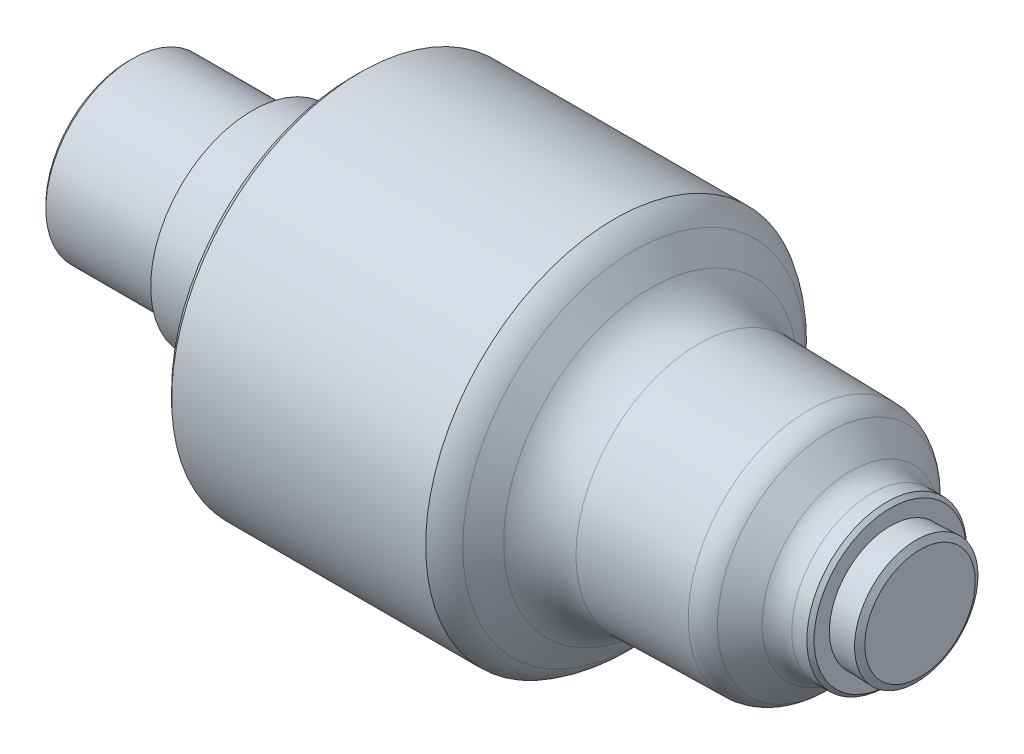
SolidWorks part; units mm, degrees
ref_plane "Ebene vorne" through (0, 0, 0) normal (0, 0, 1) x (1, 0, 0)
ref_plane "Ebene oben" through (0, 0, 0) normal (0, 1, 0) x (1, 0, 0)
ref_plane "Ebene rechts" through (0, 0, 0) normal (1, 0, 0) x (0, 0, -1)
sketch "Skizze1" plane through (0, 0, 0) normal (0, 0, 1) x (1, 0, 0)
  line L0 (9.6088, 8.3421) -> (10.6405, 8.3421)
  line L1 (9.6088, 8.3421) -> (9.5468, 8.2801)
  line L2 (9.6088, 5.0921) -> (9.5468, 5.1541)
  line L3 (13.6093, 5.0921) -> (13.7968, 5.0921)
  line L4 (14.1718, 7.3736) -> (14.1718, 6.0606)
  line L5 (12.535, 7.7481) -> (13.4861, 7.7481)
  line L6 (14.1408, 7.4046) -> (13.9869, 7.4046)
  line L7 (14.1408, 7.4046) -> (14.1718, 7.3736)
  line L8 (11.9647, 8.1909) -> (12.1254, 7.9613)
  line L9 (13.8845, 7.4579) -> (13.7932, 7.5882)
  line L10 (14.1408, 6.0296) -> (14.0468, 6.0296)
  line L11 (14.1408, 6.0296) -> (14.1718, 6.0606)
  line L12 (13.9218, 5.9046) -> (13.9218, 5.2171)
  line L13 (19.5501, 6.7171) -> (19.5501, 5.4611)
  line L14 (17.4881, 6.7171) -> (17.4881, 5.4611)
  line L15 (3.1815, 6.7171) -> (1.5785, 6.7171) construction
  line L16 (3.3315, 6.8671) -> (3.3315, 8.741) construction
  line L17 (3.4815, 6.7171) -> (5.0645, 6.7171) construction
  line L18 (3.3315, 6.5671) -> (3.3315, 4.9879) construction
  line L19 (2.7255, 7.8537) -> (3.066, 7.8537)
  line L20 (3.9375, 7.8537) -> (3.5971, 7.8537)
  line L21 (12.9218, 6.3671) -> (12.9218, 5.1453) construction
  line L22 (11.3898, 5.5929) -> (11.3898, 5.0369) construction
  line L23 (9.6088, 5.0921) -> (11.2203, 5.0921)
  line L24 (13.6093, 5.2791) -> (12.2343, 5.2791)
  line L25 (12.2343, 5.2791) -> (12.2343, 5.0921)
  line L26 (13.6093, 5.2791) -> (13.6093, 5.0921)
  line L27 (11.5593, 5.0921) -> (12.2343, 5.0921)
  line L28 (13.5778, 5.3491) -> (12.2658, 5.3491)
  line L29 (12.2343, 5.2791) -> (12.2658, 5.3491)
  line L30 (13.6093, 5.2791) -> (13.5778, 5.3491)
  line L31 (13.5063, 5.3904) -> (13.4856, 5.9856)
  line L32 (13.5778, 5.3491) -> (13.5063, 5.3904)
  line L33 (12.3372, 5.3904) -> (12.3439, 5.5808)
  line L34 (12.2658, 5.3491) -> (12.3372, 5.3904)
  line L35 (12.3372, 5.3904) -> (13.5063, 5.3904)
  line L36 (14.1718, 7.2418) -> (14.3954, 7.2486)
  line L37 (14.1718, 6.1933) -> (14.3959, 6.1865)
  line L38 (8.8378, 7.5921) -> (8.8378, 7.4646)
  line L39 (8.7408, 7.5921) -> (8.7408, 5.8421)
  line L40 (8.7408, 7.5921) -> (8.8378, 7.5921)
  line L41 (8.7408, 5.8421) -> (8.8378, 5.8421)
  line L42 (7.356, 6.7171) -> (8.6726, 6.7171) construction
  line L43 (14.4278, 7.1926) -> (14.4278, 6.2417)
  line L44 (14.4278, 7.1926) -> (14.3954, 7.2486)
  line L45 (14.4278, 6.2417) -> (14.3959, 6.1865)
  line L46 (8.8378, 7.4646) -> (9.5468, 7.4646)
  line L47 (8.8378, 5.9696) -> (9.5468, 5.9696)
  line L48 (9.5468, 8.2801) -> (9.5468, 5.1541)
  line L49 (8.8378, 5.9696) -> (8.8378, 5.8421)
  line L50 (9.6088, 5.0921) -> (9.6088, 8.3421)
  line L51 (13.6427, 11.5171) -> (13.8316, 11.7127)
  line L52 (13.6427, 13.4359) -> (13.8316, 13.2404)
  line L53 (9.6088, 10.851) -> (9.6088, 14.102)
  line L54 (9.5468, 10.913) -> (9.5468, 14.04)
  line L55 (9.6088, 10.851) -> (11.7962, 10.851)
  line L56 (9.6088, 10.851) -> (9.5468, 10.913)
  line L57 (9.6088, 14.102) -> (11.7962, 14.102)
  line L58 (9.6088, 14.102) -> (9.5468, 14.04)
  line L59 (14.4877, 12.4765) -> (10.6547, 12.4765) construction
  line L60 (12.519, 13.5308) -> (13.4678, 13.5122)
  line L61 (14.0114, 11.789) -> (14.1408, 11.789)
  line L62 (14.0114, 13.164) -> (14.1408, 13.164)
  line L63 (7.5025, 12.4765) -> (10.1889, 12.4765) construction
  line L64 (8.8378, 12.9314) -> (8.8378, 12.0217) construction
  line L65 (8.7408, 13.3515) -> (8.7408, 11.6015)
  line L66 (8.7408, 11.6015) -> (9.5468, 11.6015)
  line L67 (8.8378, 12.0217) -> (9.5468, 12.0217)
  line L68 (8.7408, 13.3515) -> (9.5468, 13.3515)
  line L69 (8.8378, 12.9314) -> (9.5468, 12.9314)
  line L70 (11.7962, 8.3421) -> (11.7962, 5.0921)
  line L71 (12.4128, 6.8844) -> (12.4128, 7.57)
  line L72 (13.9291, 7.2958) -> (13.9291, 6.1438)
  line L73 (13.4945, 5.9856) -> (12.6723, 5.9856)
  line L74 (13.557, 6.0481) -> (13.557, 6.1184)
  line L75 (14.3959, 6.1865) -> (14.3954, 7.2486)
  line L76 (14.3959, 11.9459) -> (14.3954, 13.008)
  line L77 (14.4278, 12.952) -> (14.4278, 12.0011)
  line L78 (14.1718, 13.0012) -> (14.3954, 13.008)
  line L79 (14.4278, 12.952) -> (14.3954, 13.008)
  line L80 (14.4278, 12.0011) -> (14.3959, 11.9459)
  line L81 (14.1718, 11.9527) -> (14.3959, 11.9459)
  line L82 (14.1408, 6.0296) -> (14.1408, 7.4046)
  line L83 (18.4291, 6.7171) -> (18.6091, 6.7171) construction
  line L84 (18.5191, 6.6271) -> (18.5191, 6.8071) construction
  line L85 (18.3391, 6.7171) -> (16.8041, 6.7171) construction
  line L86 (18.6991, 6.7171) -> (20.2341, 6.7171) construction
  line L87 (18.5191, 6.5371) -> (18.5191, 5.0021) construction
  line L88 (18.5191, 6.8971) -> (18.5206, 8.8156) construction
  line L89 (13.5379, 6.8844) -> (13.5379, 7.57)
  line L90 (14.1408, 11.789) -> (14.1408, 13.164)
  line L91 (14.1718, 13.133) -> (14.1718, 11.82)
  line L92 (14.1408, 11.789) -> (14.1718, 11.82)
  line L93 (14.1408, 13.164) -> (14.1718, 13.133)
  line L94 (11.7962, 14.102) -> (11.7962, 10.851)
  line L95 (11.9647, 13.9508) -> (12.1095, 13.744)
  line L96 (12.519, 11.4222) -> (13.4678, 11.4409)
  line L97 (11.9647, 11.0022) -> (12.1095, 11.209)
  line L98 (13.9291, 13.0552) -> (13.9291, 11.9032)
  line L99 (13.5379, 11.6703) -> (13.5379, 13.3294)
  line L100 (12.4128, 11.6323) -> (12.4128, 13.3294)
  line L101 (19.1965, 8.2549) -> (19.1844, 8.2305)
  line L102 (19.2441, 8.2384) -> (19.2853, 8.2179)
  line L103 (19.2296, 8.2386) -> (19.2174, 8.214)
  line L104 (19.3273, 8.19) -> (19.3151, 8.1656)
  line L105 (19.2943, 8.2065) -> (19.282, 8.1819)
  line L106 (19.3478, 8.1149) -> (19.358, 8.1321)
  line L107 (17.7139, 8.19) -> (17.726, 8.1656)
  line L108 (17.6934, 8.1149) -> (17.6832, 8.1321)
  line L109 (17.8446, 8.2549) -> (17.8568, 8.2305)
  line L110 (17.797, 8.2384) -> (17.7558, 8.2179)
  line L111 (17.8115, 8.2386) -> (17.8238, 8.214)
  line L112 (17.7469, 8.2065) -> (17.7591, 8.1819)
  line L113 (11.6405, 13.3104) -> (10.7655, 13.3104)
  line L114 (10.6405, 13.202) -> (10.6405, 11.751) construction
  line L115 (11.7655, 13.202) -> (11.7655, 11.751) construction
  line L116 (11.6405, 11.6427) -> (10.7655, 11.6427)
  line L117 (11.5864, 11.7823) -> (11.5864, 11.7044)
  line L118 (11.6947, 11.7823) -> (11.6947, 11.7044)
  line L119 (11.6947, 11.7044) -> (11.6405, 11.672)
  line L120 (11.5864, 11.7044) -> (11.6405, 11.672)
  line L121 (11.6405, 11.8136) -> (11.6405, 11.8002)
  line L122 (11.6947, 11.7823) -> (11.6405, 11.8136)
  line L123 (11.5864, 11.7823) -> (11.6405, 11.8136)
  line L124 (10.7114, 11.7823) -> (10.7114, 11.7044)
  line L125 (10.8197, 11.7823) -> (10.8197, 11.7044)
  line L126 (10.8197, 11.7044) -> (10.7655, 11.672)
  line L127 (10.7114, 11.7044) -> (10.7655, 11.672)
  line L128 (10.8197, 11.7823) -> (10.7655, 11.8136)
  line L129 (10.7114, 11.7823) -> (10.7655, 11.8136)
  line L130 (10.7655, 11.8136) -> (10.7655, 11.8002)
  line L145 (11.6405, 8.1334) -> (10.7655, 8.1334)
  line L146 (10.8197, 8.1749) -> (10.8197, 8.2338)
  line L147 (10.7114, 8.1749) -> (10.7114, 8.2338)
  line L148 (10.8197, 8.2338) -> (10.7655, 8.2524)
  line L149 (10.7114, 8.2338) -> (10.7655, 8.2524)
  line L150 (10.8197, 8.1749) -> (10.7655, 8.1574)
  line L151 (10.7655, 8.1574) -> (10.7655, 8.1707)
  line L152 (10.7114, 8.1749) -> (10.7655, 8.1574)
  line L153 (11.6405, 8.1149) -> (10.7655, 8.1149)
  line L154 (10.6405, 8.3621) -> (11.7655, 8.3621)
  line L155 (10.6405, 8.1735) -> (10.6405, 8.3621)
  line L156 (11.7655, 8.1735) -> (11.7655, 8.3621)
  line L157 (11.7655, 8.3421) -> (11.7962, 8.3421)
  line L158 (11.6405, 8.1574) -> (11.6405, 8.1707)
  line L159 (11.5864, 8.1749) -> (11.6405, 8.1574)
  line L160 (11.6947, 8.1749) -> (11.6405, 8.1574)
  line L161 (11.6947, 8.2338) -> (11.6405, 8.2524)
  line L162 (11.5864, 8.2338) -> (11.6405, 8.2524)
  line L163 (11.5864, 8.1749) -> (11.5864, 8.2338)
  line L164 (11.6947, 8.1749) -> (11.6947, 8.2338)
  line L165 (18.8003, 6.8795) -> (18.5191, 7.0419)
  line L166 (18.5191, 7.0419) -> (18.2378, 6.8795)
  line L167 (18.2378, 6.8795) -> (18.2378, 6.5547)
  line L168 (18.2378, 6.5547) -> (18.5191, 6.3924)
  line L169 (18.5191, 6.3924) -> (18.8003, 6.5547)
  line L170 (18.8003, 6.5547) -> (18.8003, 6.8795)
  line L171 (7.6468, 7.4631) -> (8.5939, 7.4631)
  line L172 (7.6158, 7.4321) -> (7.6158, 6.7171)
  line L173 (7.6468, 7.4631) -> (7.6158, 7.4321)
  line L174 (8.6783, 7.5921) -> (8.6783, 7.4046)
  line L175 (8.6341, 7.4229) -> (8.5939, 7.4631)
  line L176 (8.6783, 7.4671) -> (8.7408, 7.4671)
  line L177 (8.6783, 7.5921) -> (8.7408, 7.5921)
  line L178 (7.6468, 7.4631) -> (7.6468, 6.7171)
  line L179 (8.5939, 7.4631) -> (8.5939, 6.7171)
  line L180 (8.5939, 5.9711) -> (8.5939, 6.7171)
  line L181 (7.6468, 5.9711) -> (7.6468, 6.7171)
  line L182 (7.6158, 6.0021) -> (7.6158, 6.7171)
  line L183 (7.6468, 5.9711) -> (8.5939, 5.9711)
  line L184 (7.6468, 5.9711) -> (7.6158, 6.0021)
  line L185 (8.6793, 5.8421) -> (8.6793, 6.0296)
  line L186 (8.6341, 6.0113) -> (8.5939, 5.9711)
  line L187 (8.6793, 5.9671) -> (8.7408, 5.9671)
  line L188 (8.6793, 5.8421) -> (8.7408, 5.8421)
  line L189 (8.6783, 11.6015) -> (8.6783, 12.4765)
  line L190 (8.6783, 11.6015) -> (8.7408, 11.6015)
  line L191 (8.5939, 13.2225) -> (8.5939, 12.4765)
  line L192 (7.6468, 13.2225) -> (7.6468, 12.4765)
  line L193 (7.6158, 13.1915) -> (7.6158, 12.4765)
  line L194 (7.6468, 11.7305) -> (8.5939, 11.7305)
  line L195 (7.6158, 11.7615) -> (7.6158, 12.4765)
  line L196 (7.6468, 11.7305) -> (7.6468, 12.4765)
  line L197 (7.6468, 11.7305) -> (7.6158, 11.7615)
  line L198 (8.5939, 11.7305) -> (8.5939, 12.4765)
  line L199 (8.6341, 11.7707) -> (8.5939, 11.7305)
  line L200 (7.6468, 13.2225) -> (8.5939, 13.2225)
  line L201 (7.6468, 13.2225) -> (7.6158, 13.1915)
  line L202 (8.6783, 13.3515) -> (8.6783, 12.4765)
  line L203 (8.6341, 13.1823) -> (8.5939, 13.2225)
  line L204 (8.6783, 13.3515) -> (8.7408, 13.3515)
  line L205 (9.6088, 6.7171) -> (14.4891, 6.7171) construction
  line L206 (3.3815, 6.7171) -> (3.2815, 6.7171) construction
  line L207 (3.3315, 6.6671) -> (3.3315, 6.7671) construction
  line L208 (3.191, 7.9787) -> (3.191, 8.0507)
  line L209 (3.4721, 7.9787) -> (3.4721, 8.0507)
  line L210 (3.5117, 8.3421) -> (3.1513, 8.3421)
  line L211 (3.1513, 8.4303) -> (3.2854, 8.4303)
  line L212 (2.5264, 8.19) -> (2.5385, 8.1656)
  line L213 (2.5058, 8.1149) -> (2.4956, 8.1321)
  line L214 (2.6095, 8.2384) -> (2.5683, 8.2179)
  line L215 (2.5593, 8.2065) -> (2.5716, 8.1819)
  line L216 (2.6571, 8.2549) -> (2.6692, 8.2305)
  line L217 (2.624, 8.2386) -> (2.6362, 8.214)
  line L218 (3.1513, 8.4303) -> (3.1513, 8.3421)
  line L219 (3.2442, 8.4303) -> (3.2442, 8.3448)
  line L220 (3.3776, 8.4303) -> (3.5117, 8.4303)
  line L221 (3.2854, 8.3723) -> (3.3776, 8.3723)
  line L222 (3.4188, 8.4303) -> (3.4188, 8.3448)
  line L223 (3.2854, 8.4303) -> (3.2854, 8.3723)
  line L224 (3.3776, 8.4303) -> (3.3776, 8.3723)
  line L225 (3.5117, 8.4303) -> (3.5117, 8.3421)
  line L226 (4.1067, 8.2065) -> (4.0945, 8.1819)
  line L227 (4.0421, 8.2386) -> (4.0298, 8.214)
  line L228 (4.0566, 8.2384) -> (4.0978, 8.2179)
  line L229 (4.009, 8.2549) -> (3.9969, 8.2305)
  line L230 (4.1397, 8.19) -> (4.1276, 8.1656)
  line L231 (4.1603, 8.1149) -> (4.1705, 8.1321)
  line L232 (18.4741, 8.3723) -> (18.5663, 8.3723)
  line L233 (18.34, 8.4303) -> (18.34, 8.3524)
  line L234 (18.4329, 8.4303) -> (18.4329, 8.3599)
  line L235 (18.4741, 8.4303) -> (18.4741, 8.3723)
  line L236 (18.34, 8.4303) -> (18.4741, 8.4303)
  line L237 (18.6075, 8.4303) -> (18.6075, 8.3597)
  line L238 (18.7004, 8.4303) -> (18.7004, 8.3521)
  line L239 (18.5663, 8.4303) -> (18.5663, 8.3723)
  line L240 (18.5663, 8.4303) -> (18.7004, 8.4303)
  line L241 (10.2547, 8.4276) -> (10.5667, 8.4276)
  line L242 (10.2547, 8.4276) -> (10.2547, 8.3421)
  line L243 (10.5667, 8.4276) -> (10.5667, 8.3421)
  line L244 (10.4107, 8.4276) -> (10.4107, 8.3421)
  line L245 (10.4107, 12.2964) -> (10.5667, 12.3864)
  line L246 (10.5667, 12.3864) -> (10.5667, 12.5666)
  line L247 (10.5667, 12.5666) -> (10.4107, 12.6567) construction
  line L248 (10.4107, 12.6567) -> (10.2547, 12.5666)
  line L249 (10.2547, 12.5666) -> (10.2547, 12.3864)
  line L250 (10.2547, 12.3864) -> (10.4107, 12.2964)
  line L251 (10.2547, 12.4505) -> (10.5667, 12.4505)
  line L252 (10.2547, 12.5025) -> (10.5667, 12.5025) construction
  line L253 (3.3815, 6.7171) -> (3.2815, 6.7171) construction
  line L254 (3.3315, 6.6671) -> (3.3315, 6.7671) construction
  line L255 (6.7909, 12.4765) -> (14.4278, 12.4765)
  circle A0 centre (18.5191, 6.7171) radius 1.625
  arc A1 (12.1254, 7.9613) -> (12.535, 7.7481) centre (12.535, 8.2481) ccw
  arc A2 (11.9647, 8.1909) -> (11.7962, 8.3421) centre (11.5551, 7.9041) ccw
  arc A3 (13.7932, 7.5882) -> (13.4861, 7.7481) centre (13.4861, 7.3731) ccw
  arc A4 (13.8845, 7.4579) -> (13.9869, 7.4046) centre (13.9869, 7.5296) ccw
  arc A5 (14.0468, 6.0296) -> (13.9218, 5.9046) centre (14.0468, 5.9046) ccw
  circle A6 centre (3.3315, 6.7171) radius 1.625
  circle A7 centre (3.3315, 6.7171) radius 0.5
  circle A8 centre (3.3315, 6.7171) radius 0.875
  circle A9 centre (3.3315, 6.7171) radius 1.341
  circle A10 centre (3.3315, 6.7171) radius 1.563
  circle A11 centre (3.3315, 6.7171) radius 1.372
  arc A12 (2.7255, 7.8537) -> (3.9375, 7.8537) centre (3.3315, 6.7746) ccw
  arc A13 (3.066, 7.8537) -> (3.191, 7.9787) centre (3.066, 7.9787) ccw
  circle A14 centre (3.066, 7.9787) radius 0.0465
  arc A15 (3.4721, 7.9787) -> (3.5971, 7.8537) centre (3.5971, 7.9787) ccw
  circle A16 centre (3.5971, 7.9787) radius 0.0465
  circle A17 centre (3.3315, 6.7171) radius 0.9221
  arc A18 (3.0139, 7.8537) -> (3.6492, 7.8537) centre (3.3315, 6.7171) ccw
  arc A19 (3.5172, 7.8826) -> (3.1458, 7.8826) centre (3.3315, 6.7171) ccw
  arc A20 (19.5501, 6.7171) -> (17.4881, 6.7171) centre (18.5191, 6.7171) ccw
  arc A21 (11.5593, 5.0921) -> (11.2203, 5.0921) centre (11.3898, 3.4716) ccw
  arc A22 (13.7968, 5.0921) -> (13.9218, 5.2171) centre (13.7968, 5.2171) ccw
  arc A23 (13.6093, 5.0921) -> (12.2343, 5.0921) centre (12.9218, 3.6352) ccw
  circle A24 centre (3.3315, 6.7171) radius 0.749
  circle A25 centre (18.5191, 6.7171) radius 0.6875
  circle A26 centre (18.5191, 6.7171) radius 0.6565
  circle A27 centre (3.3315, 6.7171) radius 0.531
  circle A28 centre (18.5191, 6.7171) radius 0.531
  arc A29 (11.7962, 5.0921) -> (11.9647, 5.2433) centre (11.5551, 5.5301) ccw
  arc A30 (13.4678, 11.4409) -> (13.6427, 11.5171) centre (13.4629, 11.6908) ccw
  arc A31 (13.6427, 13.4359) -> (13.4678, 13.5122) centre (13.4629, 13.2623) ccw
  arc A32 (14.0114, 11.789) -> (13.8316, 11.7127) centre (14.0114, 11.539) ccw
  arc A33 (13.8316, 13.2404) -> (14.0114, 13.164) centre (14.0114, 13.414) ccw
  arc A34 (13.5429, 6.6286) -> (13.8492, 6.027) centre (14.5647, 6.77) ccw
  arc A35 (11.9647, 5.2433) -> (12.4128, 6.6649) centre (7.6489, 7.3853) ccw
  arc A36 (13.4945, 5.9856) -> (13.557, 6.0481) centre (13.4945, 6.0481) ccw
  arc A37 (11.9647, 13.9508) -> (11.7962, 14.102) centre (11.5551, 13.664) ccw
  arc A38 (12.1095, 13.744) -> (12.519, 13.5308) centre (12.519, 14.0308) ccw
  arc A39 (11.7962, 10.851) -> (11.9647, 11.0022) centre (11.5551, 11.289) ccw
  arc A40 (12.519, 11.4222) -> (12.1095, 11.209) centre (12.519, 10.9222) ccw
  arc A41 (19.3273, 8.19) -> (19.1965, 8.2549) centre (19.0773, 7.8511) ccw
  arc A42 (19.2296, 8.2386) -> (19.1965, 8.2549) centre (19.1657, 8.1506) ccw
  arc A43 (19.1844, 8.2305) -> (19.3151, 8.1656) centre (19.4344, 8.5694) ccw
  arc A44 (19.1844, 8.2305) -> (19.2174, 8.214) centre (19.249, 8.3181) ccw
  arc A45 (19.2943, 8.2065) -> (19.2296, 8.2386) centre (19.2168, 8.1318) ccw
  arc A46 (19.2174, 8.214) -> (19.282, 8.1819) centre (19.2948, 8.2887) ccw
  arc A47 (19.3273, 8.19) -> (19.2943, 8.2065) centre (19.2627, 8.1024) ccw
  arc A48 (19.282, 8.1819) -> (19.3151, 8.1656) centre (19.3459, 8.2699) ccw
  arc A49 (17.726, 8.1656) -> (17.8568, 8.2305) centre (17.6068, 8.5694) ccw
  arc A50 (17.726, 8.1656) -> (17.7591, 8.1819) centre (17.6952, 8.2699) ccw
  arc A51 (17.8446, 8.2549) -> (17.8115, 8.2386) centre (17.8754, 8.1506) ccw
  arc A52 (17.8238, 8.214) -> (17.8568, 8.2305) centre (17.7922, 8.3181) ccw
  arc A53 (17.8115, 8.2386) -> (17.7469, 8.2065) centre (17.8243, 8.1318) ccw
  arc A54 (17.8446, 8.2549) -> (17.7139, 8.19) centre (17.9639, 7.8511) ccw
  arc A55 (17.7591, 8.1819) -> (17.8238, 8.214) centre (17.7463, 8.2887) ccw
  arc A56 (17.7469, 8.2065) -> (17.7139, 8.19) centre (17.7785, 8.1024) ccw
  arc A57 (19.358, 8.1321) -> (17.6824, 8.1334) centre (18.5191, 6.7171) ccw
  arc A58 (11.5864, 11.769) -> (11.6405, 11.8002) centre (11.5751, 11.8511) ccw
  arc A59 (11.6405, 11.8002) -> (11.6947, 11.769) centre (11.706, 11.8511) ccw
  arc A60 (10.7655, 11.8002) -> (10.8197, 11.769) centre (10.831, 11.8511) ccw
  arc A61 (10.7114, 11.769) -> (10.7655, 11.8002) centre (10.7001, 11.8511) ccw
  arc A66 (10.8197, 8.1882) -> (10.7655, 8.1707) centre (10.8121, 8.1194) ccw
  arc A67 (10.7655, 8.1707) -> (10.7114, 8.1882) centre (10.719, 8.1194) ccw
  arc A68 (11.6947, 8.1882) -> (11.6405, 8.1707) centre (11.6871, 8.1194) ccw
  arc A69 (11.6405, 8.1707) -> (11.5864, 8.1882) centre (11.594, 8.1194) ccw
  arc A70 (8.6341, 7.4229) -> (8.7408, 7.4671) centre (8.6783, 7.4671) ccw
  arc A71 (8.7408, 5.9671) -> (8.6341, 6.0113) centre (8.6783, 5.9671) ccw
  arc A72 (8.6783, 11.789) -> (8.6341, 11.7707) centre (8.6783, 11.7265) ccw
  arc A73 (8.6341, 13.1823) -> (8.6783, 13.164) centre (8.6783, 13.2265) ccw
  arc A74 (4.1705, 8.1321) -> (3.5117, 8.3522) centre (3.3315, 6.7171) ccw
  arc A75 (4.1397, 8.19) -> (4.1067, 8.2065) centre (4.0751, 8.1024) ccw
  arc A76 (4.1397, 8.19) -> (4.009, 8.2549) centre (3.8897, 7.8511) ccw
  arc A77 (4.0945, 8.1819) -> (4.1276, 8.1656) centre (4.1584, 8.2699) ccw
  arc A78 (3.9969, 8.2305) -> (4.1276, 8.1656) centre (4.2469, 8.5694) ccw
  arc A79 (3.1513, 8.3522) -> (2.4948, 8.1334) centre (3.3315, 6.7171) ccw
  arc A80 (2.5385, 8.1656) -> (2.6692, 8.2305) centre (2.4192, 8.5694) ccw
  arc A81 (2.5385, 8.1656) -> (2.5716, 8.1819) centre (2.5077, 8.2699) ccw
  arc A82 (2.624, 8.2386) -> (2.5593, 8.2065) centre (2.6368, 8.1318) ccw
  arc A83 (2.6571, 8.2549) -> (2.5264, 8.19) centre (2.7764, 7.8511) ccw
  arc A84 (2.5716, 8.1819) -> (2.6362, 8.214) centre (2.5588, 8.2887) ccw
  arc A85 (2.5593, 8.2065) -> (2.5264, 8.19) centre (2.591, 8.1024) ccw
  arc A86 (2.6571, 8.2549) -> (2.624, 8.2386) centre (2.6879, 8.1506) ccw
  arc A87 (2.6362, 8.214) -> (2.6692, 8.2305) centre (2.6046, 8.3181) ccw
  arc A88 (4.0298, 8.214) -> (4.0945, 8.1819) centre (4.1073, 8.2887) ccw
  arc A89 (4.1067, 8.2065) -> (4.0421, 8.2386) centre (4.0293, 8.1318) ccw
  arc A90 (3.9969, 8.2305) -> (4.0298, 8.214) centre (4.0615, 8.3181) ccw
  arc A91 (4.0421, 8.2386) -> (4.009, 8.2549) centre (3.9782, 8.1506) ccw
  ellipse E0 centre (11.3898, 7.5296) end of major axis (11.5593, 7.5296) minor radius 0.1422 (11.5593, 7.5296) -> (11.2203, 7.5296) ccw
  ellipse E1 centre (11.3898, 7.5296) end of major axis (11.2203, 7.5296) minor radius 0.151 (11.2203, 7.5296) -> (11.5593, 7.5296) ccw
  ellipse E2 centre (11.3898, 13.8838) end of major axis (11.2203, 13.8838) minor radius 0.077 (11.5593, 13.8838) -> (11.2203, 13.8838) ccw construction
  ellipse E3 centre (11.3898, 13.8838) end of major axis (11.2203, 13.8838) minor radius 0.0923 (11.2203, 13.8838) -> (11.5593, 13.8838) ccw
  ellipse E4 centre (11.6405, 11.751) end of major axis (11.7655, 11.751) minor radius 0.1083 (11.6405, 11.6427) -> (11.7655, 11.751) ccw
  ellipse E5 centre (10.7655, 11.751) end of major axis (10.6405, 11.751) minor radius 0.1083 (10.6405, 11.751) -> (10.7655, 11.6427) ccw
  ellipse E6 centre (10.7655, 13.202) end of major axis (10.6405, 13.202) minor radius 0.1083 (10.7655, 13.3104) -> (10.6405, 13.202) ccw
  ellipse E7 centre (11.6405, 13.202) end of major axis (11.7655, 13.202) minor radius 0.1083 (11.7655, 13.202) -> (11.6405, 13.3104) ccw
  ellipse E8 centre (11.6405, 11.7332) end of major axis (11.6947, 11.7332) minor radius 0.0517 (11.5864, 11.7332) -> (11.6947, 11.7332) ccw
  ellipse E9 centre (11.6405, 11.7332) end of major axis (11.5864, 11.7332) minor radius 0.0513 (11.6947, 11.7332) -> (11.5864, 11.7332) ccw
  ellipse E10 centre (10.7655, 11.7332) end of major axis (10.8197, 11.7332) minor radius 0.0517 (10.7114, 11.7332) -> (10.8197, 11.7332) ccw
  ellipse E11 centre (10.7655, 11.7332) end of major axis (10.7114, 11.7332) minor radius 0.0513 (10.8197, 11.7332) -> (10.7114, 11.7332) ccw
  ellipse E16 centre (10.7655, 8.2147) end of major axis (10.8197, 8.2147) minor radius 0.0315 (10.8197, 8.2147) -> (10.7114, 8.2147) ccw
  ellipse E17 centre (10.7655, 8.2147) end of major axis (10.7114, 8.2147) minor radius 0.0318 (10.7114, 8.2147) -> (10.8197, 8.2147) ccw
  ellipse E18 centre (10.7655, 8.192) end of major axis (10.8905, 8.192) minor radius 0.0586 (10.6405, 8.192) -> (10.7655, 8.1334) ccw
  ellipse E19 centre (11.6405, 8.192) end of major axis (11.5155, 8.192) minor radius 0.0586 (11.6405, 8.1334) -> (11.7655, 8.192) ccw
  ellipse E20 centre (11.6405, 8.1735) end of major axis (11.5155, 8.1735) minor radius 0.0586 (11.6405, 8.1149) -> (11.7655, 8.1735) ccw
  ellipse E21 centre (10.7655, 8.1735) end of major axis (10.8905, 8.1735) minor radius 0.0586 (10.6405, 8.1735) -> (10.7655, 8.1149) ccw
  ellipse E22 centre (11.6405, 8.2147) end of major axis (11.5864, 8.2147) minor radius 0.0318 (11.5864, 8.2147) -> (11.6947, 8.2147) ccw
  ellipse E23 centre (11.6405, 8.2147) end of major axis (11.6947, 8.2147) minor radius 0.0315 (11.6947, 8.2147) -> (11.5864, 8.2147) ccw
  ellipse E24 centre (11.3898, 7.3496) end of major axis (11.5593, 7.3496) minor radius 0.1422 (11.5235, 7.4369) -> (11.256, 7.4369) ccw
  ellipse E25 centre (11.3898, 13.7323) end of major axis (11.2203, 13.7323) minor radius 0.077 (11.4653, 13.8012) -> (11.3142, 13.8012) ccw
  ellipse E26 centre (11.3898, 11.2208) end of major axis (11.2203, 11.2208) minor radius 0.077 (11.3142, 11.1519) -> (11.4653, 11.1519) ccw
  ellipse E27 centre (11.3898, 11.0692) end of major axis (11.2203, 11.0692) minor radius 0.077 (11.2203, 11.0692) -> (11.5593, 11.0692) ccw
  ellipse E28 centre (11.3898, 11.0692) end of major axis (11.2203, 11.0692) minor radius 0.0923 (11.5593, 11.0692) -> (11.2203, 11.0692) ccw
revolve "Rotation1" add sketch "Skizze1" angle 360 about L59
equation "\"LÄNGE\"=0"
equation "\"BREITE\"=0"
equation "\"HÖHE\"=0"
equation "\"DURCHMESSER\"=0"
equation "\"Stückzahl\"= 1"
